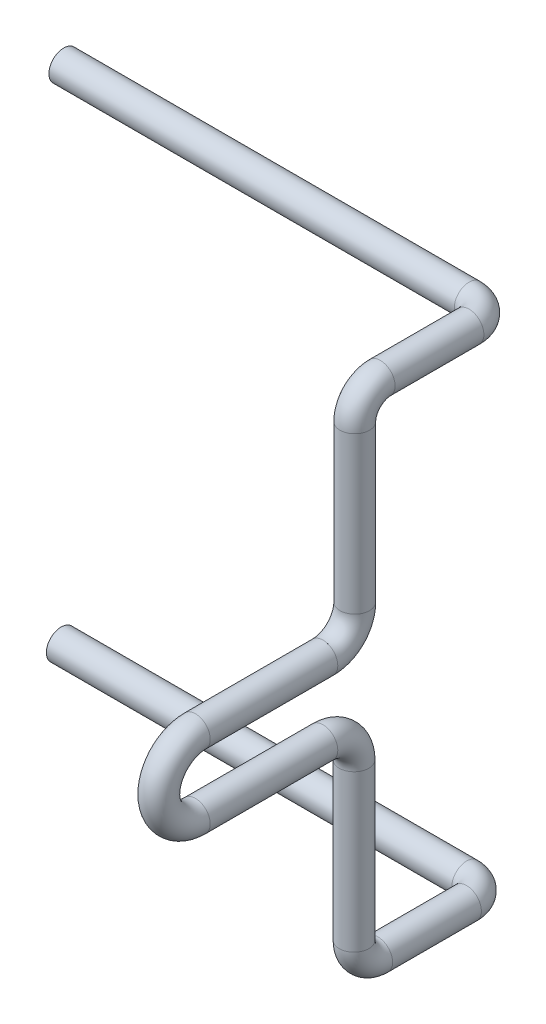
SolidWorks part; units mm, degrees
ref_plane "Front Plane" through (0, 0, 0) normal (0, 0, 1) x (1, 0, 0)
ref_plane "Top Plane" through (0, 0, 0) normal (0, 1, 0) x (1, 0, 0)
ref_plane "Right Plane" through (0, 0, 0) normal (1, 0, 0) x (0, 0, -1)
sketch "Sketch1" plane through (0, 0, 0) normal (0, 0, 1) x (1, 0, 0)
  circle A0 centre (0, 0) radius 1.27
  dimension "D1" = 2.54
extrude "Boss-Extrude1" add sketch "Sketch1" along normal blind 10.9474
sketch "Sketch2" plane through (0, 0, 10.9474) normal (0, 0, 1) x (1, 0, 0)
  line L0 (-3.1551, -3.1458) -> (4.8172, -3.1458) construction
  circle A1 centre (0, 0) radius 1.27
  circle A2 centre (0, 0) radius 1.27
  dimension "D1" = 0
revolve "Revolve1" add sketch "Sketch2" angle 180 about L0
sketch "Sketch3" plane through (0, 0, 10.9474) normal (0, 0, -1) x (-1, 0, 0)
  circle A1 centre (0, -6.2915) radius 1.27
  circle A2 centre (0, -6.2915) radius 1.27
  dimension "D1" = 0
extrude "Boss-Extrude2" add sketch "Sketch3" along normal blind 10.9474
sketch "Sketch5" plane through (0, 0, 0) normal (0, 0, -1) x (-1, 0, 0)
  line L0 (-3.2135, -8.957) -> (3.9397, -8.957) construction
  circle A1 centre (0, -6.2915) radius 1.27
  circle A2 centre (0, -6.2915) radius 1.27
  dimension "D1" = 0
revolve "Revolve2" add sketch "Sketch5" angle 90 about L0
sketch "Sketch6" plane through (0, 0, 0) normal (0, 0, -1) x (-1, 0, 0)
  line L0 (-2.711, 2.7279) -> (4.2352, 2.7279) construction
  circle A1 centre (0, 0) radius 1.27
  circle A2 centre (0, 0) radius 1.27
  dimension "D1" = 0
revolve "Revolve3" add sketch "Sketch6" angle 90 about L0
sketch "Sketch7" plane through (0, -8.957, 0) normal (0, -1, 0) x (1, 0, 0)
  circle A1 centre (0, -2.6655) radius 1.27
  circle A2 centre (0, -2.6655) radius 1.27
  dimension "D1" = 0
extrude "Boss-Extrude3" add sketch "Sketch7" along normal blind 13.4112
sketch "Sketch8" plane through (0, 2.7279, 0) normal (0, 1, 0) x (1, 0, 0)
  circle A1 centre (0, 2.7279) radius 1.27
  circle A2 centre (0, 2.7279) radius 1.27
  dimension "D1" = 0
extrude "Boss-Extrude4" add sketch "Sketch8" along normal blind 13.4112
sketch "Sketch9" plane through (0, 16.1391, 0) normal (0, 1, 0) x (1, 0, 0)
  line L0 (-1.8866, 4.9209) -> (2.3991, 4.9209) construction
  circle A1 centre (0, 2.7279) radius 1.27
  circle A2 centre (0, 2.7279) radius 1.27
  dimension "D1" = 0
sketch "Sketch10" plane through (0, -22.3682, 0) normal (0, -1, 0) x (1, 0, 0)
  line L0 (-2.1939, -4.7061) -> (2.8803, -4.7061) construction
  circle A1 centre (0, -2.6655) radius 1.27
  circle A2 centre (0, -2.6655) radius 1.27
  dimension "D1" = 0
revolve "Revolve6" add sketch "Sketch9" angle 90 about L0
revolve "Revolve7" add sketch "Sketch10" angle 90 about L0
sketch "Sketch13" plane through (0, 0, -4.7061) normal (0, 0, -1) x (-1, 0, 0)
  circle A1 centre (0, -24.4088) radius 1.27
  circle A2 centre (0, -24.4088) radius 1.27
  dimension "D1" = 0
extrude "Boss-Extrude7" add sketch "Sketch13" along normal blind 7.62
sketch "Sketch14" plane through (0, 0, -4.9209) normal (0, 0, -1) x (-1, 0, 0)
  circle A1 centre (0, 18.3321) radius 1.27
  circle A2 centre (0, 18.3321) radius 1.27
  dimension "D1" = 0
extrude "Boss-Extrude8" add sketch "Sketch14" along normal blind 7.62
sketch "Sketch15" plane through (0, 0, -12.5409) normal (0, 0, -1) x (-1, 0, 0)
  line L0 (2.0078, 21.5327) -> (2.0078, 18.0295) construction
  circle A1 centre (0, 18.3321) radius 1.27
  circle A2 centre (0, 18.3321) radius 1.27
  dimension "D1" = 0
revolve "Revolve8" add sketch "Sketch15" angle 90 about L0
sketch "Sketch17" plane through (0, 0, -12.3261) normal (0, 0, -1) x (-1, 0, 0)
  line L0 (1.8218, -24.861) -> (1.8218, -27.548) construction
  circle A1 centre (0, -24.4088) radius 1.27
  circle A2 centre (0, -24.4088) radius 1.27
  dimension "D1" = 0
revolve "Revolve9" add sketch "Sketch17" angle 90 about L0
sketch "Sketch18" plane through (-1.8218, 0, 0) normal (-1, 0, 0) x (0, 0, 1)
  circle A1 centre (-14.1479, -24.4088) radius 1.27
  circle A2 centre (-14.1479, -24.4088) radius 1.27
  dimension "D1" = 0
extrude "Boss-Extrude9" add sketch "Sketch18" along normal blind 34.798
sketch "Sketch19" plane through (-2.0078, 0, 0) normal (-1, 0, 0) x (0, 0, 1)
  circle A1 centre (-14.5487, 18.3321) radius 1.27
  circle A2 centre (-14.5487, 18.3321) radius 1.27
  dimension "D1" = 0
extrude "Boss-Extrude10" add sketch "Sketch19" along normal blind 34.798
